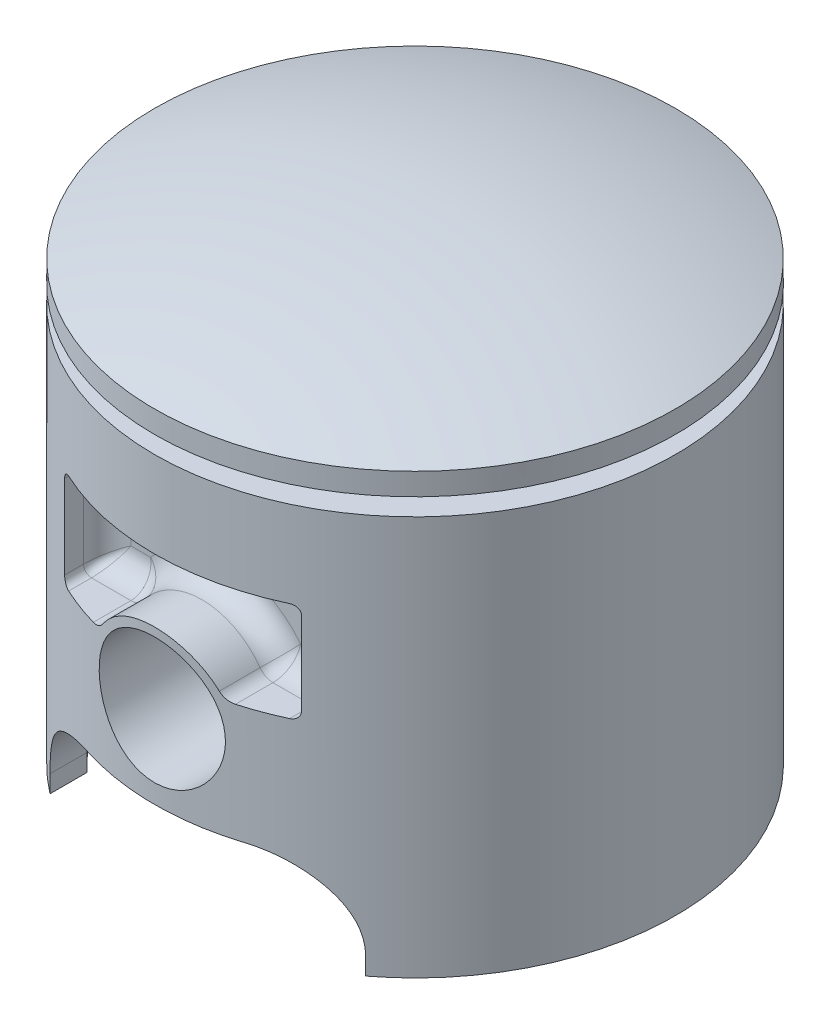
SolidWorks part; units mm, degrees
ref_plane "Plan1" through (0, 0, 0) normal (0, 0, 1) x (1, 0, 0)
ref_plane "Plan2" through (0, 0, 0) normal (0, 1, 0) x (1, 0, 0)
ref_plane "Plan3" through (0, 0, 0) normal (1, 0, 0) x (0, 0, -1)
sketch "Esquisse1" plane through (0, 0, 0) normal (0, 0, 1) x (1, 0, 0)
  line L0 (0, 39) -> (0, 22)
  line L1 (-33, 33) -> (-33, 30.2)
  line L2 (-33, -22.6) -> (-29.4, -22.6)
  line L3 (-29.4, -22.6) -> (-29.4, 22)
  line L4 (-29.4, 22) -> (0, 22)
  line L5 (-33, 30.2) -> (-29, 30.2)
  line L6 (0, 0) -> (0, 39) construction
  line L7 (-29, 30.2) -> (-29, 28)
  line L8 (-29, 28) -> (-33, 28)
  line L9 (-33, 28) -> (-33, -22.6)
  arc A1 (0, 39) -> (-33, 33) centre (0, -54.75) ccw
  point P8 (0, 42.0526)
  dimension "D2" = 33
  dimension "D4" = 22
  dimension "D1" = 6
  dimension "D3" = 3.6
  dimension "D5" = 33
  dimension "D6" = 61.6
  dimension "D7" = 2.8
  dimension "D8" = 2.2
  dimension "D9" = 4
revolve "Base-Révolution" add sketch "Esquisse1" angle 180 about L6
sketch "Esquisse2" plane through (0, 0, 0) normal (0, 0, 1) x (1, 0, 0)
  line L1 (-20, -22.6) -> (20, -22.6)
  line L2 (-20, -22.6) -> (-20, -20.4)
  line L3 (-10, -10.4) -> (10, -10.4)
  line L4 (20, -22.6) -> (20, -20.4)
  line L5 (0, 0) -> (0, 39) construction
  line L6 (-29.4, -22.6) -> (29.4, -22.6) construction
  arc A0 (-20, -20.4) -> (-10, -10.4) centre (-10, -20.4) cw
  arc A1 (20, -20.4) -> (10, -10.4) centre (10, -20.4) ccw
  dimension "D1" = 2.2
  dimension "D2" = 10
  dimension "D3" = 12.2
  dimension "D4" = 20
  dimension "D5" = 10
extrude "Enlèv. mat.-Extru.1" cut sketch "Esquisse2" along normal through all
ref_plane "Plan4" through (0, 0, 13) normal (0, 0, 1) x (1, 0, 0)
sketch "Esquisse3" plane through (0, 0, 13) normal (0, 0, 1) x (1, 0, 0)
  line L0 (-16, 6) -> (-16, 22)
  line L1 (29.4, 22) -> (-29.4, 22) construction
  line L2 (16, 6) -> (16, 22)
  line L4 (-16, 22) -> (16, 22)
  arc A0 (-16, 6) -> (16, 6) centre (0, 6) ccw
  dimension "D1" = 32
  dimension "D2" = 16
  dimension "D3" = 16
extrude "Boss.-Extru.1" add sketch "Esquisse3" along normal up to next
ref_plane "Plan6" through (0, 0, 24) normal (0, 0, 1) x (1, 0, 0)
sketch "Esquisse6" plane through (0, -10.4, 0) normal (0, -1, 0) x (1, 0, 0)
  line L0 (0, 0) -> (0, -18.6349) construction
  line L1 (0, 40.8724) -> (0, 17.2583) construction
  line L2 (-26.3697, 13) -> (-23.8619, 13)
  line L3 (-29.3759, 0) -> (39.2878, 0) construction
  line L7 (23.8619, 13) -> (26.3697, 13)
  arc A0 (-16, 24.665) -> (-29.4, 0) centre (0, 0) ccw construction
  arc A1 (23.8619, 13) -> (-23.8619, 13) centre (0, 0) ccw
  arc A2 (-0.245, 29.399) -> (-29.4, 0) centre (0, 0) ccw construction
  arc A9 (26.3697, 13) -> (-26.3697, 13) centre (0, 0) ccw
extrude "Boss.-Extru.2" add sketch "Esquisse6" against normal up to surface (32.4 mm away)
sketch "Esquisse5" plane through (0, 0, 24) normal (0, 0, 1) x (1, 0, 0)
  line L0 (0, 0) -> (0, 39) construction
  line L1 (-14, 17.0875) -> (14, 17.0875)
  line L2 (-15, 16.0875) -> (-15, 5.4756)
  line L3 (-14, 4.4756) -> (-9, 4.4756)
  line L4 (15, 16.0875) -> (15, 5.4756)
  line L5 (9, 4.4756) -> (14, 4.4756)
  arc A0 (7.3766, 5.3075) -> (-7.3766, 5.3075) centre (0, 0) ccw
  arc A1 (-15, 16.0875) -> (-14, 17.0875) centre (-14, 16.0875) cw
  arc A2 (-9, 4.4756) -> (-7.3766, 5.3075) centre (-9, 6.4756) ccw
  arc A3 (9, 4.4756) -> (7.3766, 5.3075) centre (9, 6.4756) cw
  arc A4 (15, 16.0875) -> (14, 17.0875) centre (14, 16.0875) ccw
  arc A5 (14, 4.4756) -> (15, 5.4756) centre (14, 5.4756) ccw
  arc A6 (-14, 4.4756) -> (-15, 5.4756) centre (-14, 5.4756) cw
  point P9 (0, 9.0875)
  dimension "D5" = 1
  dimension "D6" = 5
  dimension "D1" = 2
  dimension "D2" = 15
  dimension "D3" = 30
  dimension "D4" = 8
extrude "Enlèv. mat.-Extru.3" cut sketch "Esquisse5" along normal up to next
fillet "Congé6" radius 3
sketch "Esquisse8" plane through (0, 0, 0) normal (0, 0, 1) x (1, 0, 0)
  circle A0 centre (0, 0) radius 8
  dimension "D1" = 16
extrude "Enlèv. mat.-Extru.4" cut sketch "Esquisse8" along normal through all
mirror "Tout symétriser1"
